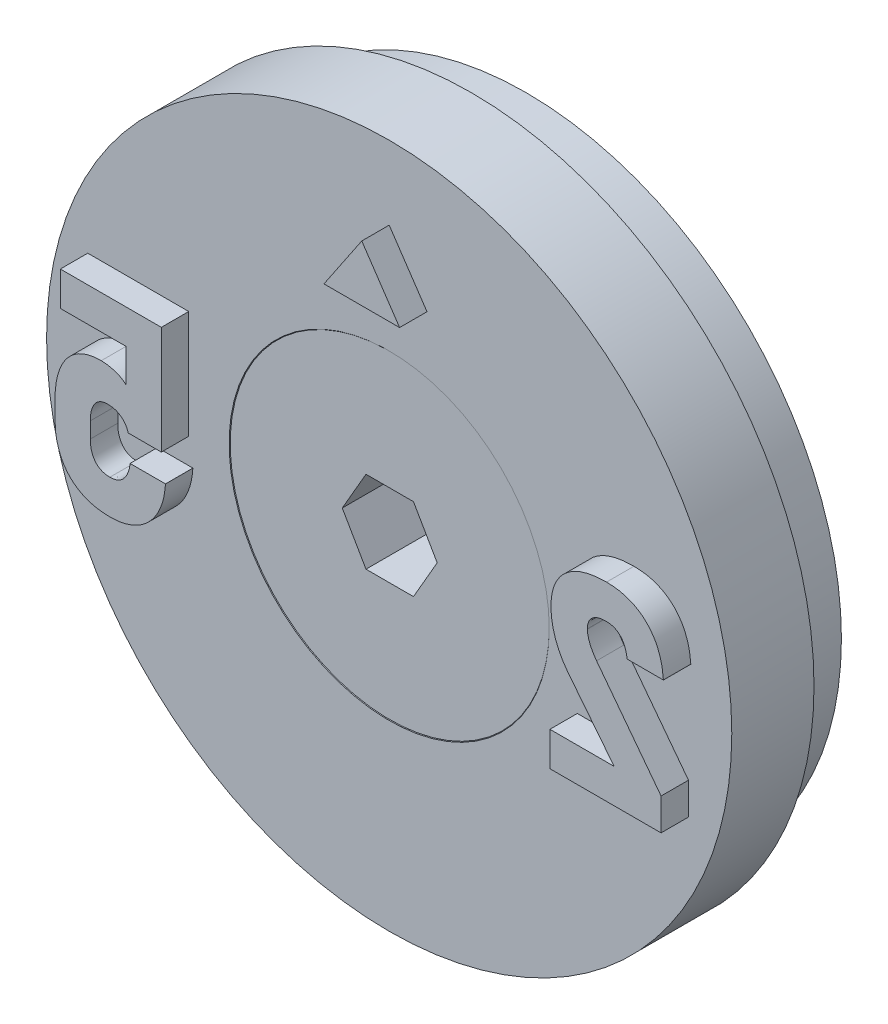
SolidWorks part; units mm, degrees
other "<M5 X .8 FHCS>-<Imported1>"
ref_plane "Front Plane" through (0, 0, 0) normal (0, 0, 1) x (1, 0, 0)
ref_plane "Top Plane" through (0, 0, 0) normal (0, 1, 0) x (1, 0, 0)
ref_plane "Right Plane" through (0, 0, 0) normal (1, 0, 0) x (0, 0, -1)
imported_body "Imported1"
sketch "Sketch1" plane through (0, 0, 0) normal (0, 0, 1) x (1, 0, 0)
  line L0 (0, 9.814) -> (-1.38, 7.768)
  line L1 (-1.38, 7.768) -> (1.38, 7.768)
  line L2 (1.38, 7.768) -> (0, 9.814)
  text T0 "2     5" font "Bahnschrift" height 6.858
  dimension "D1" = 3.429
extrude "Boss-Extrude1" add sketch "Sketch1" along normal blind 1
other "DeleteFace1"
inserted part "M5 X .8 FHCS"
move or copy body "Body-Move/Copy2" placed by mates yes
